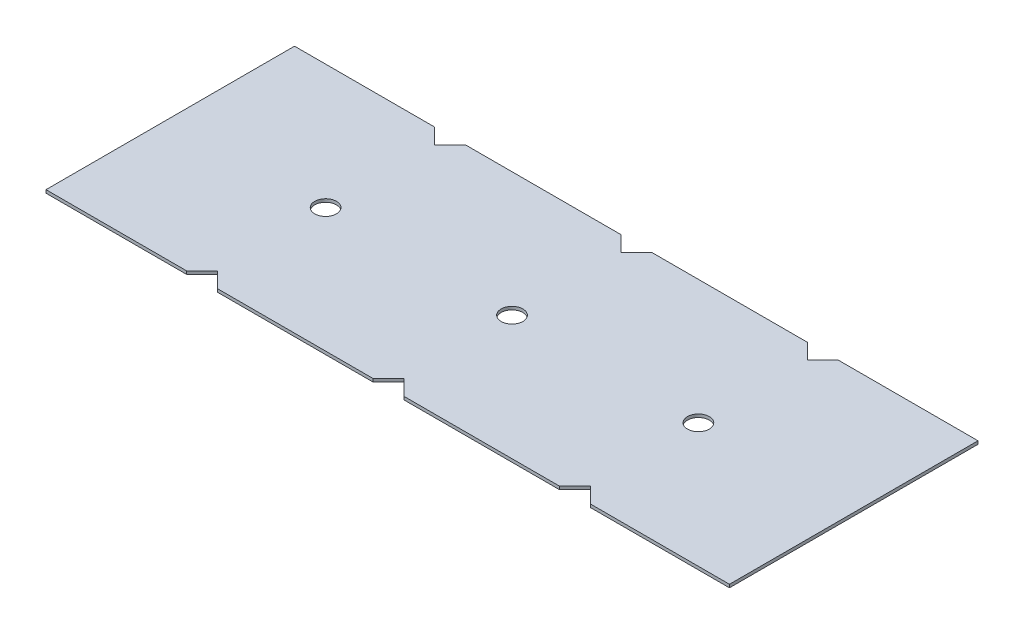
SolidWorks part; units mm, degrees
ref_plane "Plan de face" through (0, 0, 0) normal (0, 0, 1) x (1, 0, 0)
ref_plane "Plan de dessus" through (0, 0, 0) normal (0, 1, 0) x (1, 0, 0)
ref_plane "Plan de droite" through (0, 0, 0) normal (1, 0, 0) x (0, 0, -1)
sketch "Esquisse1" plane through (0, 0, 0) normal (0, 0, 1) x (1, 0, 0)
  line L1 (0, 0) -> (220, 0)
  line L2 (0, 0) -> (0, 1)
  line L3 (0, 1) -> (220, 1)
  line L4 (220, 0) -> (220, 1)
  dimension "D1" = 220
  dimension "D2" = 1
extrude "Extrusion1" add sketch "Esquisse1" against normal blind 80
ref_plane "Plan1" through (0, 1, -80) normal (0, 0, 1) x (1, 0, 0)
sketch "Esquisse3" plane through (0, 1, 0) normal (0, 1, 0) x (-1, 0, 0)
  line L0 (8.7585, -40) -> (-220, -40) construction
  line L1 (-220, -80) -> (-220, 0) construction
  line L2 (-110, -80) -> (-110, 3.5007) construction
  line L5 (-220, -80) -> (0, -80) construction
  circle A0 centre (-110, -40) radius 3.5
  dimension "D1" = 7
extrude "Enlèv. mat.-Extru.1" cut sketch "Esquisse3" against normal blind 1
pattern_linear "Répétition linéaire1" count 2 spacing 60 along (1, 0, 0) count 2 spacing 60 along (-1, 0, 0) of "Enlèv. mat.-Extru.1"
sketch "Esquisse4" plane through (0, 1, 0) normal (0, 1, 0) x (-1, 0, 0)
  line L0 (-50, 21.3145) -> (-50, -90.0341) construction
  line L2 (0, -75) -> (-220.1589, -75) construction
  line L3 (-110, -87.123) -> (-110, 8.5785) construction
  line L4 (-170, -87.123) -> (-170, 8.5785) construction
  line L5 (0, -80) -> (0, 0) construction
  line L9 (-115.0795, -80) -> (-110.0795, -75)
  line L10 (-105.0795, -80) -> (-115.0795, -80)
  line L11 (-110.0795, -75) -> (-105.0795, -80)
extrude "Enlèv. mat.-Extru.2" cut sketch "Esquisse4" against normal blind 1
pattern_linear "Répétition linéaire3" count 2 spacing 60 along (1, 0, 0) count 2 spacing 60 along (-1, 0, 0) of "Enlèv. mat.-Extru.2"
ref_plane "Plan2" through (0, 1, 0) normal (-1, 0, 0) x (0, 0, 1)
sketch "Esquisse8" plane through (0, 1, 0) normal (0, 1, 0) x (-1, 0, 0)
  line L0 (3.2514, -5) -> (-223.8122, -5) construction
  line L1 (-220, 0) -> (0, 0) construction
  line L3 (-110.2804, -5) -> (-105.2804, 0)
  line L4 (-110.2804, -5) -> (-115.2804, 0)
  line L5 (-105.2804, 0) -> (-115.2804, 0)
  dimension "D1" = 5
extrude "Enlèv. mat.-Extru.3" cut sketch "Esquisse8" against normal blind 1
pattern_linear "Répétition linéaire4" count 2 spacing 60 along (1, 0, 0) count 2 spacing 60 along (-1, 0, 0) of "Enlèv. mat.-Extru.3"
